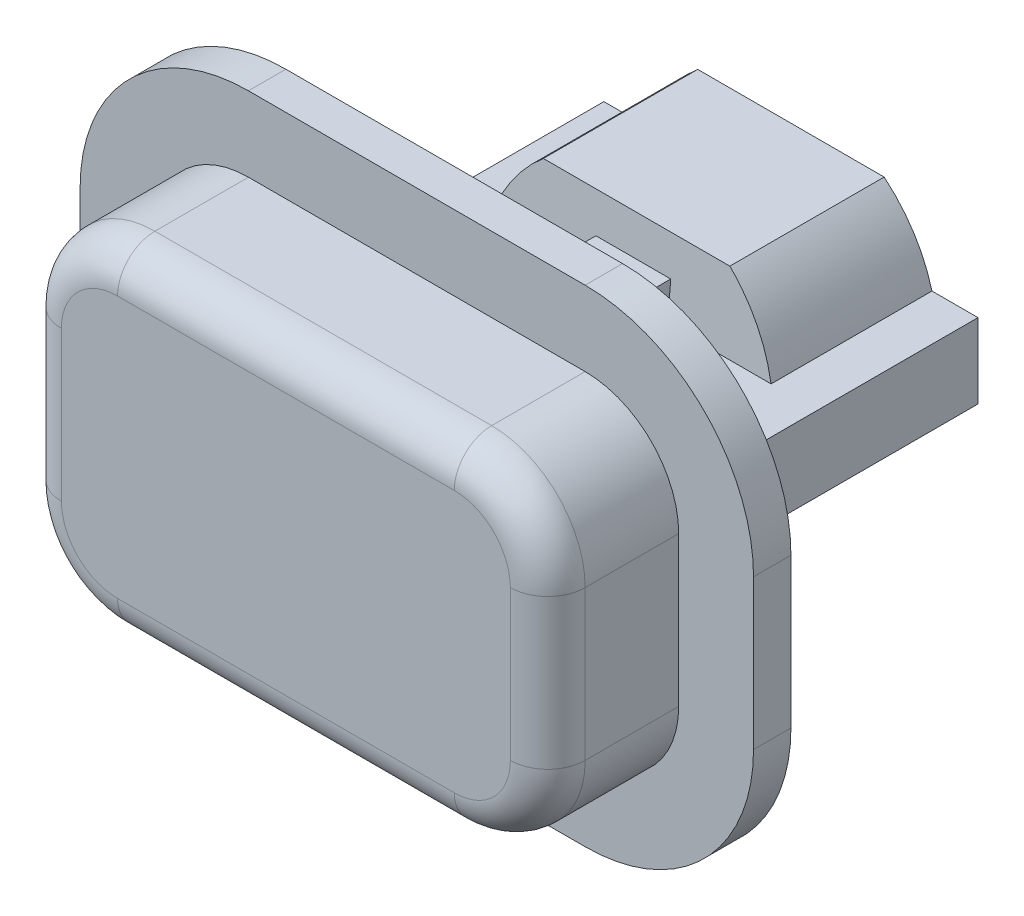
SolidWorks part; units mm, degrees
ref_plane "Front" through (0, 0, 0) normal (0, 0, 1) x (1, 0, 0)
ref_plane "Top" through (0, 0, 0) normal (0, 1, 0) x (1, 0, 0)
ref_plane "Right" through (0, 0, 0) normal (1, 0, 0) x (0, 0, -1)
sketch "Sketch1" plane through (0, 0, 0) normal (0, 0, 1) x (1, 0, 0)
  line L0 (0, 4.5) -> (0, 0) construction
  line L1 (-4.5, 4.5) -> (4.5, 4.5)
  line L2 (-7, 2) -> (-7, -2)
  line L3 (-4.5, -4.5) -> (4.5, -4.5)
  line L4 (7, 2) -> (7, -2)
  line L5 (0, 0) -> (-7, 0) construction
  line L6 (-7.5, 0) -> (-7.5, -2) construction
  line L7 (-4.5, -5) -> (4.5, -5) construction
  arc A0 (-7, -2) -> (-4.5, -4.5) centre (-4.5, -2) ccw
  arc A1 (7, -2) -> (4.5, -4.5) centre (4.5, -2) cw
  arc A2 (-4.5, 4.5) -> (-7, 2) centre (-4.5, 2) ccw
  arc A3 (7, 2) -> (4.5, 4.5) centre (4.5, 2) ccw
  arc A5 (-7.5, -2) -> (-4.5, -5) centre (-4.5, -2) ccw construction
  dimension "D3" = 0.5
  dimension "D1" = 0.5
  dimension "D2" = 0.5
extrude "Extrude1" add sketch "Sketch1" against normal blind 3.5
sketch "Sketch2" plane through (0, 0, -3.5) normal (0, 0, -1) x (-1, 0, 0)
  line L0 (-4.5, 4.5) -> (4.5, 4.5) construction
  line L1 (4.5, 6.5) -> (-4.5, 6.5)
  line L2 (9, 2) -> (9, -2)
  line L3 (4.5, -6.5) -> (-4.5, -6.5)
  line L4 (-9, 2) -> (-9, -2)
  line L5 (7, 2) -> (7, -2) construction
  line L6 (4.5, -4.5) -> (-4.5, -4.5) construction
  line L7 (-7, -2) -> (-7, 2) construction
  arc A0 (4.5, 6.5) -> (9, 2) centre (4.5, 2) cw
  arc A1 (-9, 2) -> (-4.5, 6.5) centre (-4.5, 2) cw
  arc A2 (-9, -2) -> (-4.5, -6.5) centre (-4.5, -2) ccw
  arc A3 (9, -2) -> (4.5, -6.5) centre (4.5, -2) cw
  arc A4 (7, 2) -> (4.5, 4.5) centre (4.5, 2) ccw construction
  dimension "D5" = 2
  dimension "D1" = 2
  dimension "D2" = 2
  dimension "D3" = 2
  dimension "D4" = 2
extrude "Extrude2" add sketch "Sketch2" along normal blind 1
fillet "Fillet1" radius 1 8 edges at (-7, 0, 0) (-6.2678, 3.7678, 0) (0, 4.5, 0) (6.2678, 3.7678, 0) (7, 0, 0) (6.2678, -3.7678, 0) (0, -4.5, 0) (-6.2678, -3.7678, 0)
sketch "Sketch3" plane through (0, 0, -4.5) normal (0, 0, -1) x (-1, 0, 0)
  line L1 (0, 0) -> (0, 1) construction
  line L2 (-5, 1) -> (5, 1)
  line L3 (-5, 1) -> (-5, -1)
  line L4 (-5, -1) -> (5, -1)
  line L5 (5, 1) -> (5, -1)
  line L6 (0, 0) -> (-5, 0) construction
  dimension "D1" = 2
  dimension "D2" = 5
  dimension "D3" = 10
extrude "Extrude3" add sketch "Sketch3" along normal blind 9
sketch "Sketch4" plane through (0, 0, -4.5) normal (0, 0, -1) x (-1, 0, 0)
  line L0 (0, 0) -> (0, 2) construction
  line L1 (-1, 2) -> (1, 2)
  line L2 (-1, 2) -> (-1, -2)
  line L3 (-1, -2) -> (1, -2)
  line L4 (1, 2) -> (1, -2)
  line L5 (0, 2) -> (0, 0) construction
  line L6 (0, 0) -> (1, 0) construction
  line L7 (5, 1) -> (-5, 1) construction
  dimension "D1" = 2
  dimension "D2" = 1
extrude "Extrude4" add sketch "Sketch4" along normal up to surface (9 mm away)
ref_plane "Plane1" through (0, 0, -9.2) normal (0, 0, -1) x (-1, 0, 0)
sketch "Sketch5" plane through (0, 0, -9.2) normal (0, 0, -1) x (-1, 0, 0)
  circle A0 centre (0, 0) radius 3.9
  dimension "D1" = 7.8
extrude "Extrude5" add sketch "Sketch5" along normal up to surface (4.3 mm away)
sketch "Sketch6" plane through (0, 0, -13.5) normal (0, 0, -1) x (-1, 0, 0)
  circle A0 centre (0, 0) radius 1.9
  dimension "D1" = 3.8
extrude "Cut-Extrude1" cut sketch "Sketch6" against normal blind 2
draft "Draft1" type of draft neutral plane draft angle 5 faces to draft 1 parameters "D1"=5
draft "Draft2" type of draft neutral plane draft angle 5 faces to draft 1 parameters "D1"=5
sketch "Sketch7" plane through (0, 0, -13.5) normal (0, 0, -1) x (-1, 0, 0)
  line L1 (-4.2871, 4.9223) -> (4.1345, 4.9223)
  line L2 (-4.2871, 4.9223) -> (-4.2871, 3)
  line L3 (-4.2871, 3) -> (4.1345, 3)
  line L4 (4.1345, 4.9223) -> (4.1345, 3)
  dimension "D1" = 3
extrude "Cut-Extrude2" cut sketch "Sketch7" against normal up to surface (9 mm away)
